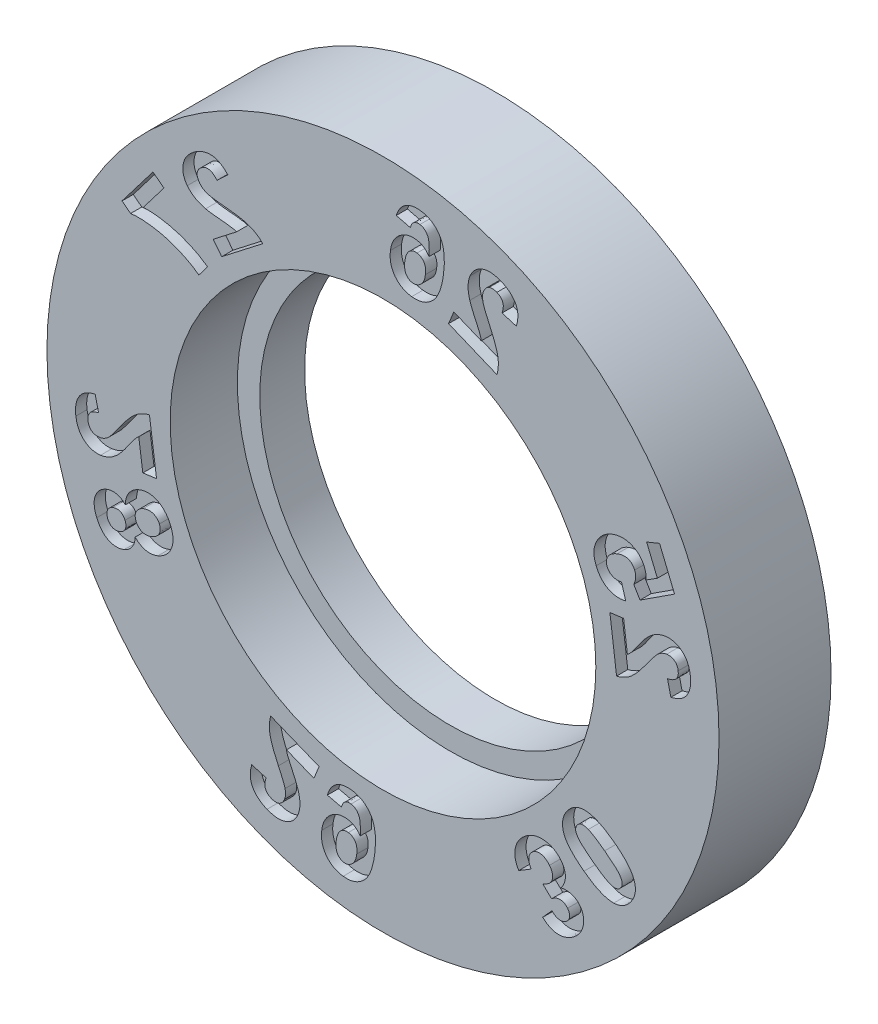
SolidWorks part; units mm, degrees
ref_plane "Front Plane" through (0, 0, 0) normal (0, 0, 1) x (1, 0, 0)
ref_plane "Top Plane" through (0, 0, 0) normal (0, 1, 0) x (1, 0, 0)
ref_plane "Right Plane" through (0, 0, 0) normal (1, 0, 0) x (0, 0, -1)
imported_body "Imported1"
other "DeleteFace3"
sketch "Sketch1" plane through (0, 0, 0) normal (0, 0, 1) x (1, 0, 0)
  line L0 (0, 0) -> (0, 16.3507) construction
  line L1 (0, 0) -> (14.1601, 8.1754) construction
  line L2 (0, 0) -> (14.1601, -8.1754) construction
  line L3 (0, 0) -> (0, -16.3507) construction
  line L4 (0, 0) -> (-14.1601, -8.1754) construction
  line L5 (0, 0) -> (-14.1601, 8.1754) construction
  circle A0 centre (0, 0) radius 10.4416 construction
  text T0 "25    26    27    28    29    30" font "Arial" height 3.5
  point P11 (0, 0)
  dimension "D1" = 6
extrude "Cut-Extrude1" cut sketch "Sketch1" against normal blind 0.5
